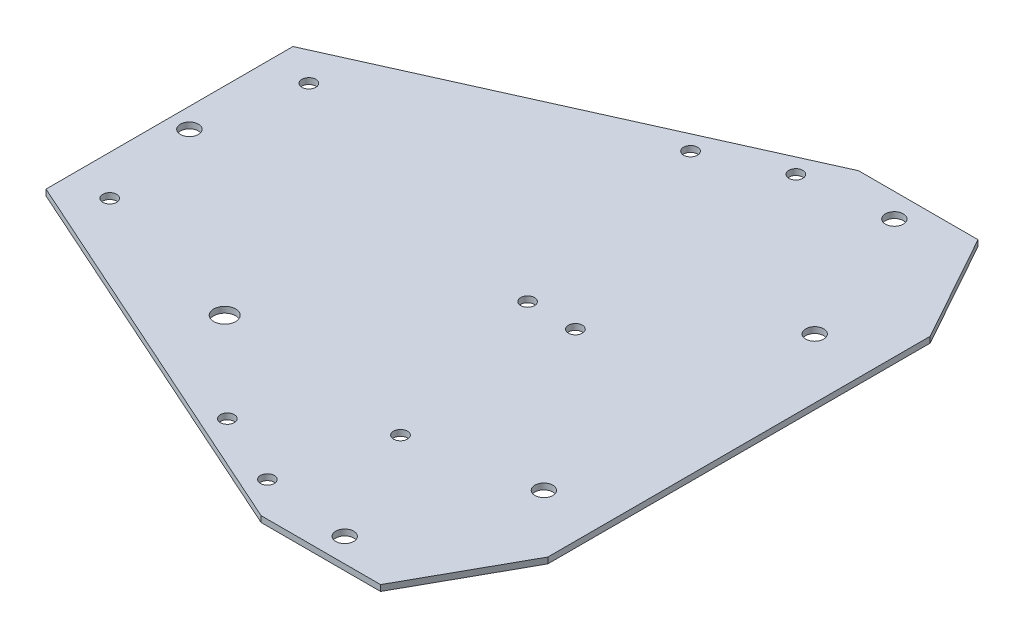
SolidWorks part; units mm, degrees
ref_plane "Front Plane" through (0, 0, 0) normal (0, 0, 1) x (1, 0, 0)
ref_plane "Top Plane" through (0, 0, 0) normal (0, 1, 0) x (1, 0, 0)
ref_plane "Right Plane" through (0, 0, 0) normal (1, 0, 0) x (0, 0, -1)
sketch "Sketch1" plane through (0, 0, 0) normal (0, 1, 0) x (1, 0, 0)
  line L0 (0, 0) -> (143, 0) construction
  line L1 (0, -31) -> (0, 31)
  line L2 (0, 31) -> (98, 75)
  line L3 (98, 75) -> (128, 75)
  line L4 (128, 75) -> (143, 48)
  line L5 (143, 48) -> (143, -48)
  line L6 (72.6799, 58.1509) -> (100.048, 70.4387) construction
  line L7 (98, 75) -> (100.048, 70.4387) construction
  line L8 (128, -75) -> (143, -48)
  line L9 (98, -75) -> (128, -75)
  line L10 (0, -31) -> (98, -75)
  line L11 (143, -48) -> (37.8636, -48) construction
  line L12 (84.92, 5) -> (96.92, 5) construction
  circle A0 centre (5, 0) radius 2.25
  circle A1 centre (10, 25) radius 1.75
  circle A2 centre (113, 69) radius 2.25
  circle A3 centre (128, 34) radius 2.25
  circle A4 centre (72.6799, 58.1509) radius 1.75
  circle A5 centre (90.9253, 66.3427) radius 1.75
  circle A6 centre (72.6799, -58.1509) radius 1.75
  circle A7 centre (90.9253, -66.3427) radius 1.75
  circle A8 centre (113, -69) radius 2.25
  circle A9 centre (128, -34) radius 2.25
  circle A10 centre (10, -25) radius 1.75
  circle A11 centre (49.8636, -36) radius 2.75
  circle A12 centre (98, -40) radius 1.75
  circle A13 centre (84.92, 5) radius 1.75
  circle A14 centre (96.92, 5) radius 1.75
  dimension "D7" = 5
  dimension "D8" = 4.5
  dimension "D9" = 25
  dimension "D10" = 10
  dimension "D11" = 3.5
  dimension "D13" = 15
  dimension "D14" = 4.5
  dimension "D15" = 34
  dimension "D16" = 15
  dimension "D17" = 4.5
  dimension "D21" = 5.5
  dimension "D22" = 12
  dimension "D23" = 12
  dimension "D24" = 8
  dimension "D25" = 30
  dimension "D27" = 12
  dimension "D28" = 46.08
  dimension "D1" = 75
  dimension "D2" = 48
  dimension "D3" = 30
  dimension "D4" = 15
  dimension "D5" = 143
  dimension "D6" = 31
  dimension "D12" = 6
  dimension "D18" = 5
  dimension "D19" = 20
  dimension "D20" = 10
  dimension "D26" = 5
base flange "Base-Flange1" sketch "Sketch1" thickness 1.5 reverse thickness direction no parameters "D1"=0.5
sketch "Bend-Lines1" [suppressed] plane through (0, 0, 0) normal (0, 1, 0) x (1, 0, 0)
sketch "Bounding-Box1" [suppressed] plane through (0, 0, 0) normal (0, 1, 0) x (1, 0, 0)
sheet metal parameters "Sheet-Metal1" thickness 1.5 parameters "D1"=0.5
flat pattern "Flat-Pattern1"
sketch "Bend-Lines2" plane through (0, 0, 0) normal (0, 1, 0) x (1, 0, 0)
sketch3d "Bounding-Box2" [suppressed]
  line L0 (0, -75, 0) -> (0, 75, 0) construction
  line L1 (143, -75, 0) -> (143, 75, 0) construction
  line L2 (0, -75, 0) -> (143, -75, 0) construction
  line L3 (0, 75, 0) -> (143, 75, 0) construction
